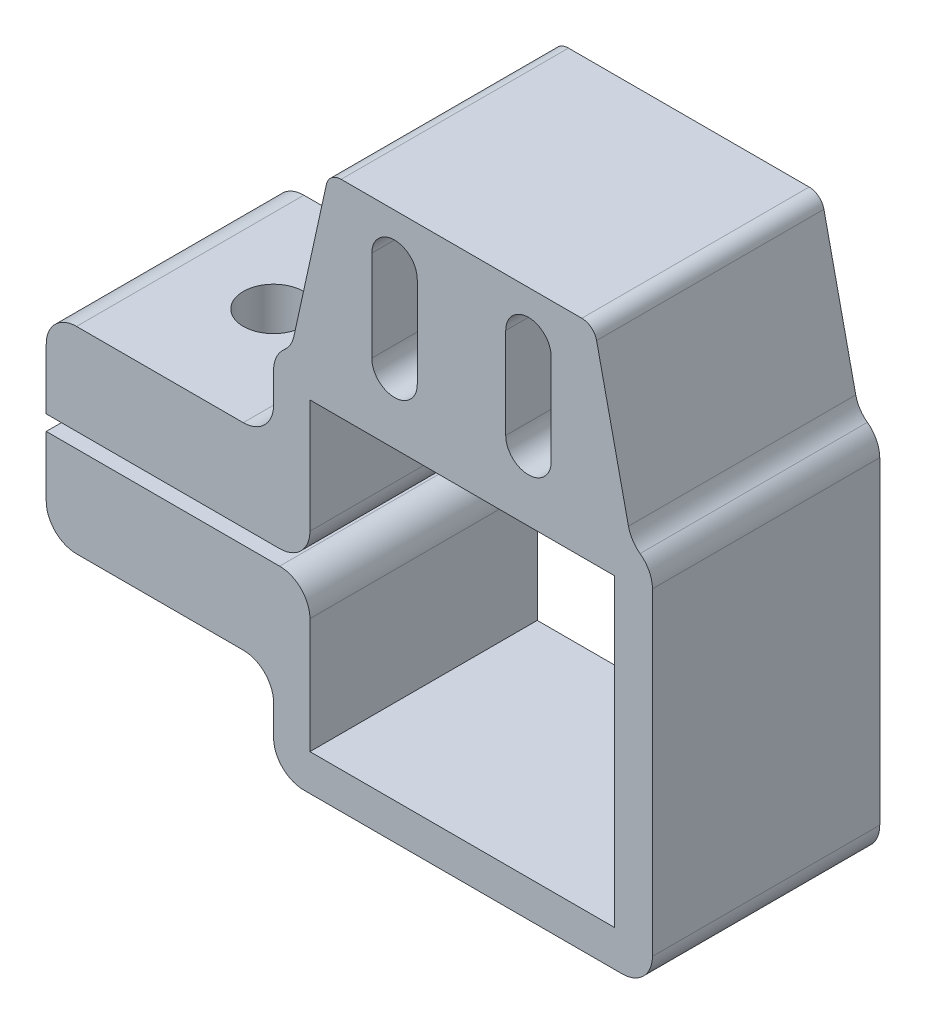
SolidWorks part; units mm, degrees
ref_plane "Front Plane" through (0, 0, 0) normal (0, 0, 1) x (1, 0, 0)
ref_plane "Top Plane" through (0, 0, 0) normal (0, 1, 0) x (1, 0, 0)
ref_plane "Right Plane" through (0, 0, 0) normal (1, 0, 0) x (0, 0, -1)
sketch "Sketch1" plane through (0, 0, 0) normal (0, 0, 1) x (1, 0, 0)
  line L0 (217.3422, -7.4014) -> (237.4422, -7.4014)
  line L1 (237.4422, -7.4014) -> (237.4422, 12.6986)
  line L2 (237.4422, 12.6986) -> (217.3422, 12.6986)
  line L3 (217.3422, 12.6986) -> (217.3422, 5.1986)
  line L4 (227.3422, 24.9403) -> (227.3422, 19.9175) construction
  line L5 (239.9422, 13.1986) -> (239.9422, -7.8014)
  line L6 (237.9422, -9.8014) -> (216.9422, -9.8014)
  line L7 (214.9422, -7.8014) -> (214.9422, -5.8014)
  line L8 (212.9422, 9.1986) -> (201.9422, 9.1986)
  line L9 (201.9422, -3.8014) -> (212.9422, -3.8014)
  line L10 (199.9422, 7.1986) -> (199.9422, 3.199)
  line L11 (199.9422, 3.199) -> (214.9422, 3.1986)
  line L12 (199.9422, 2.1986) -> (214.9422, 2.1986)
  line L13 (199.9422, 2.1986) -> (199.9422, -1.8014)
  line L14 (214.9422, 11.1986) -> (214.9422, 13.1986)
  line L15 (216.2828, 15.7981) -> (218.4257, 25.5501)
  line L16 (219.4024, 26.3355) -> (235.2819, 26.3355)
  line L17 (222.9235, 23.1265) -> (222.9235, 17.1265) construction
  line L18 (238.359, 15.9914) -> (236.2586, 25.5501)
  line L19 (224.4235, 23.1265) -> (224.4235, 17.1265)
  line L20 (221.4235, 23.1265) -> (221.4235, 17.1265)
  line L21 (231.7608, 23.1265) -> (231.7608, 17.1265) construction
  line L22 (230.2608, 23.1265) -> (230.2608, 17.1265)
  line L23 (233.2608, 23.1265) -> (233.2608, 17.1265)
  line L24 (214.9422, 3.1986) -> (215.3422, 3.1986)
  line L25 (214.9422, 2.1986) -> (215.3422, 2.1986)
  line L26 (217.3422, 0.1986) -> (217.3422, -7.4014)
  arc A0 (214.9422, 13.1986) -> (215.6358, 14.713) centre (216.9422, 13.1986) cw
  arc A1 (239.1273, 14.8096) -> (239.9422, 13.1986) centre (237.9422, 13.1986) cw
  arc A2 (239.9422, -7.8014) -> (237.9422, -9.8014) centre (237.9422, -7.8014) cw
  arc A3 (216.9422, -9.8014) -> (214.9422, -7.8014) centre (216.9422, -7.8014) cw
  arc A4 (214.9422, -5.8014) -> (212.9422, -3.8014) centre (212.9422, -5.8014) ccw
  arc A5 (214.9422, 11.1986) -> (212.9422, 9.1986) centre (212.9422, 11.1986) cw
  arc A6 (239.1273, 14.8096) -> (238.359, 15.9914) centre (240.3124, 16.4207) cw
  arc A7 (215.6358, 14.713) -> (216.2828, 15.7981) centre (214.3294, 16.2274) ccw
  arc A8 (224.4235, 23.1265) -> (221.4235, 23.1265) centre (222.9235, 23.1265) ccw
  arc A9 (221.4235, 17.1265) -> (224.4235, 17.1265) centre (222.9235, 17.1265) ccw
  arc A10 (236.2586, 25.5501) -> (235.2819, 26.3355) centre (235.2819, 25.3355) ccw
  arc A11 (219.4024, 26.3355) -> (218.4257, 25.5501) centre (219.4024, 25.3355) ccw
  arc A12 (230.2608, 23.1265) -> (233.2608, 23.1265) centre (231.7608, 23.1265) cw
  arc A13 (233.2608, 17.1265) -> (230.2608, 17.1265) centre (231.7608, 17.1265) cw
  arc A14 (217.3422, 0.1986) -> (215.3422, 2.1986) centre (215.3422, 0.1986) ccw
  arc A15 (215.3422, 3.1986) -> (217.3422, 5.1986) centre (215.3422, 5.1986) ccw
  arc A16 (201.9422, -3.8014) -> (199.9422, -1.8014) centre (201.9422, -1.8014) cw
  arc A17 (201.9422, 9.1986) -> (199.9422, 7.1986) centre (201.9422, 7.1986) ccw
  point P28 (214.9422, 9.1986)
  point P33 (227.3422, 26.3355)
  point P39 (222.9235, 20.1265)
  point P47 (236.086, 26.3355)
  point P50 (218.5983, 26.3355)
  point P53 (231.7608, 20.1265)
  point P62 (217.3422, 2.1986)
  dimension "D1" = 2
  dimension "D2" = 2
  dimension "D5" = 1
  dimension "D6" = 2
  dimension "D7" = 2
  dimension "D3" = 3
  dimension "D4" = 6
extrude "Boss-Extrude1" add sketch "Sketch1" along normal blind 15
sketch "Sketch2" plane through (0, 9.1986, 0) normal (0, 1, 0) x (-1, 0, 0)
  line L0 (-201.9422, 0) -> (-212.9422, 15) construction
  line L1 (-212.9422, 0) -> (-201.9422, 0) construction
  circle A0 centre (-207.4422, 7.5) radius 2
extrude "Cut-Extrude1" cut sketch "Sketch2" against normal blind 15
